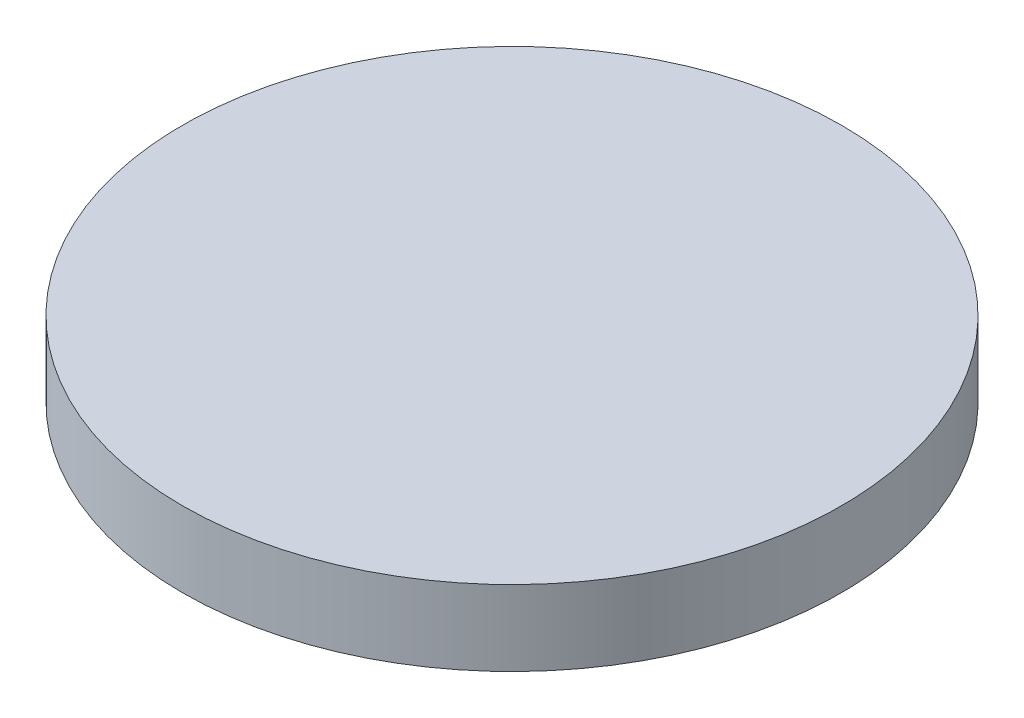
SolidWorks part; units mm, degrees
ref_plane "Front Plane" through (0, 0, 0) normal (0, 0, 1) x (1, 0, 0)
ref_plane "Top Plane" through (0, 0, 0) normal (0, 1, 0) x (1, 0, 0)
ref_plane "Right Plane" through (0, 0, 0) normal (1, 0, 0) x (0, 0, -1)
sketch "Sketch1" plane through (0, 0, 0) normal (0, 1, 0) x (1, 0, 0)
  circle A0 centre (0, 0) radius 43.75
  dimension "D1" = 87.5
extrude "Boss-Extrude1" add sketch "Sketch1" along normal blind 10
